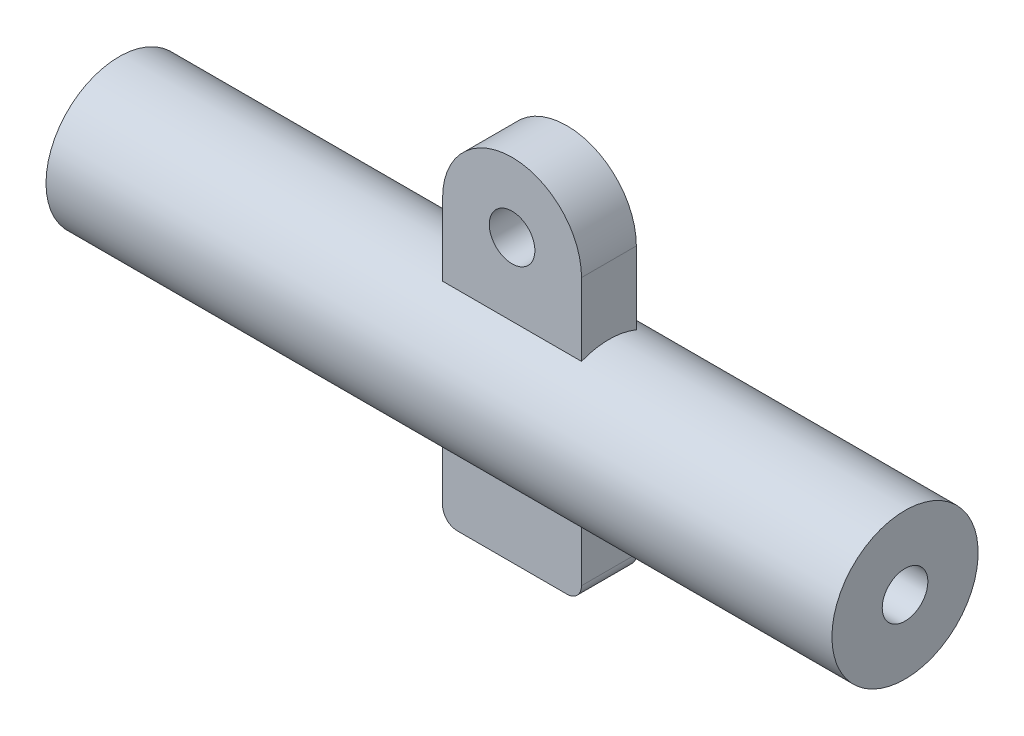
SolidWorks part; units mm, degrees
ref_plane "Front Plane" through (0, 0, 0) normal (0, 0, 1) x (1, 0, 0)
ref_plane "Top Plane" through (0, 0, 0) normal (0, 1, 0) x (1, 0, 0)
ref_plane "Right Plane" through (0, 0, 0) normal (1, 0, 0) x (0, 0, -1)
sketch "Sketch1" plane through (0, 0, 0) normal (0, 0, 1) x (1, 0, 0)
  line L0 (0, 0) -> (113.6848, 0) construction
  line L1 (0, 3.9624) -> (136.525, 3.9624)
  line L2 (136.525, 3.9624) -> (136.525, 12.7)
  line L3 (136.525, 12.7) -> (0, 12.7)
  line L4 (0, 12.7) -> (0, 3.9624)
  line L5 (60.96, -24.511) -> (85.09, -24.511)
  line L6 (85.09, -24.511) -> (85.09, 24.384)
  line L7 (60.96, 24.384) -> (60.96, -24.511)
  line L8 (73.025, 36.449) -> (96.8499, 36.449) construction
  arc A0 (85.09, 24.384) -> (60.96, 24.384) centre (73.025, 24.384) ccw
  circle A1 centre (73.025, 24.384) radius 3.9624
  dimension "D6" = 7.9248
  dimension "D8" = 60.96
  dimension "D1" = 7.9248
  dimension "D2" = 25.4
  dimension "D3" = 136.525
  dimension "D4" = 24.13
  dimension "D5" = 60.96
  dimension "D7" = 11.684
sketch "Sketch2" plane through (0, 0, 0) normal (0, 0, 1) x (1, 0, 0)
  line L0 (0, 3.9624) -> (136.525, 3.9624) construction
  line L1 (136.525, 3.9624) -> (136.525, 12.7) construction
  line L2 (136.525, 12.7) -> (0, 12.7) construction
  line L3 (0, 12.7) -> (0, 3.9624) construction
  line L4 (0, 3.9624) -> (136.525, 3.9624)
  line L5 (136.525, 3.9624) -> (136.525, 12.7)
  line L6 (136.525, 12.7) -> (0, 12.7)
  line L7 (0, 12.7) -> (0, 3.9624)
revolve "Revolve1" add sketch "Sketch2" angle 360 about L0
sketch "Sketch3" plane through (0, 0, 0) normal (0, 0, 1) x (1, 0, 0)
  line L0 (60.96, -24.511) -> (85.09, -24.511) construction
  line L1 (85.09, -24.511) -> (85.09, 24.384) construction
  line L2 (60.96, 24.384) -> (60.96, -24.511) construction
  line L3 (60.96, -24.511) -> (85.09, -24.511)
  line L4 (85.09, -24.511) -> (85.09, 24.384)
  line L5 (60.96, 24.384) -> (60.96, -24.511)
  arc A0 (85.09, 24.384) -> (60.96, 24.384) centre (73.025, 24.384) ccw construction
  circle A1 centre (73.025, 24.384) radius 3.9624 construction
  arc A2 (85.09, 24.384) -> (60.96, 24.384) centre (73.025, 24.384) ccw
  circle A3 centre (73.025, 24.384) radius 3.9624
extrude "Boss-Extrude1" add sketch "Sketch3" along normal mid plane 9.525
fillet "Fillet1" radius 2.54 2 edges at (60.96, -24.511, 0) (85.09, -24.511, 0)
